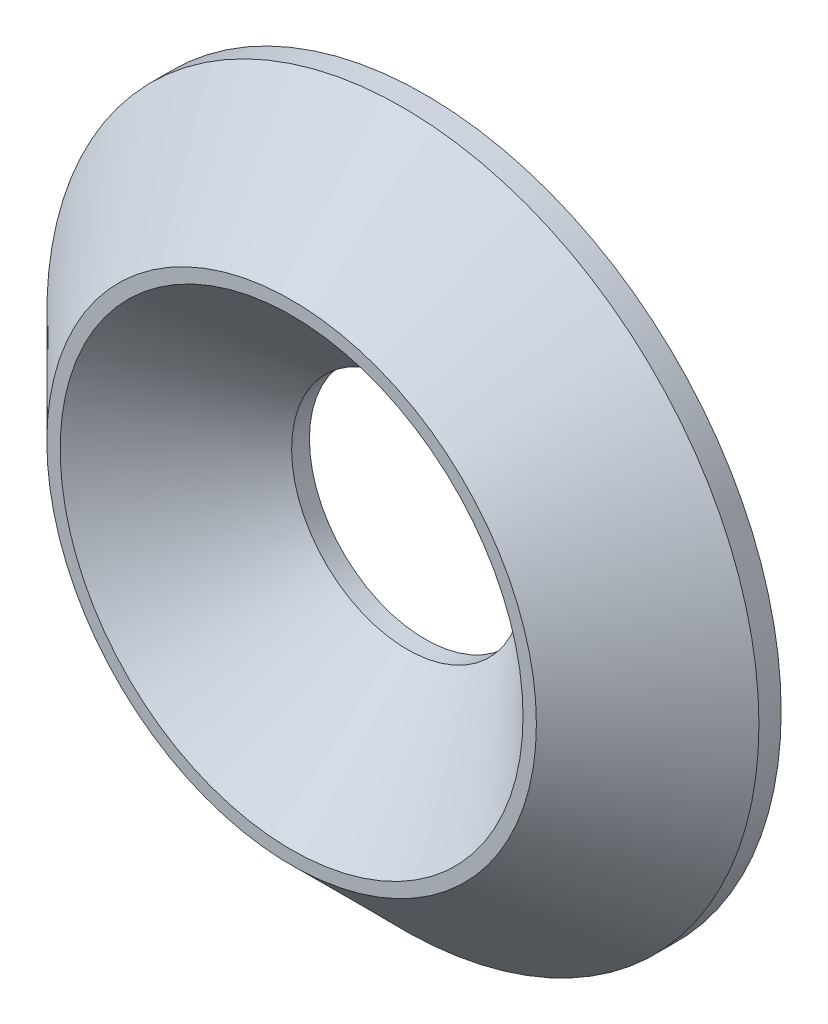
SolidWorks part; units mm, degrees
ref_plane "Plan1" through (0, 0, 0) normal (0, 0, 1) x (1, 0, 0)
ref_plane "Plan2" through (0, 0, 0) normal (0, 1, 0) x (1, 0, 0)
ref_plane "Plan3" through (0, 0, 0) normal (1, 0, 0) x (0, 0, -1)
sketch "Esquisse1" plane through (0, 0, 0) normal (0, 0, 1) x (1, 0, 0)
  circle A0 centre (0, 0) radius 2.6
  circle A1 centre (0, 0) radius 8
  dimension "D1" = 16
  dimension "D2" = 5.2
extrude "Base-Extrusion" add sketch "Esquisse1" along normal blind 3
chamfer "Chanfrein2" distance 2.5 angle 45
chamfer "Chanfrein3" distance 2.6 angle 45
